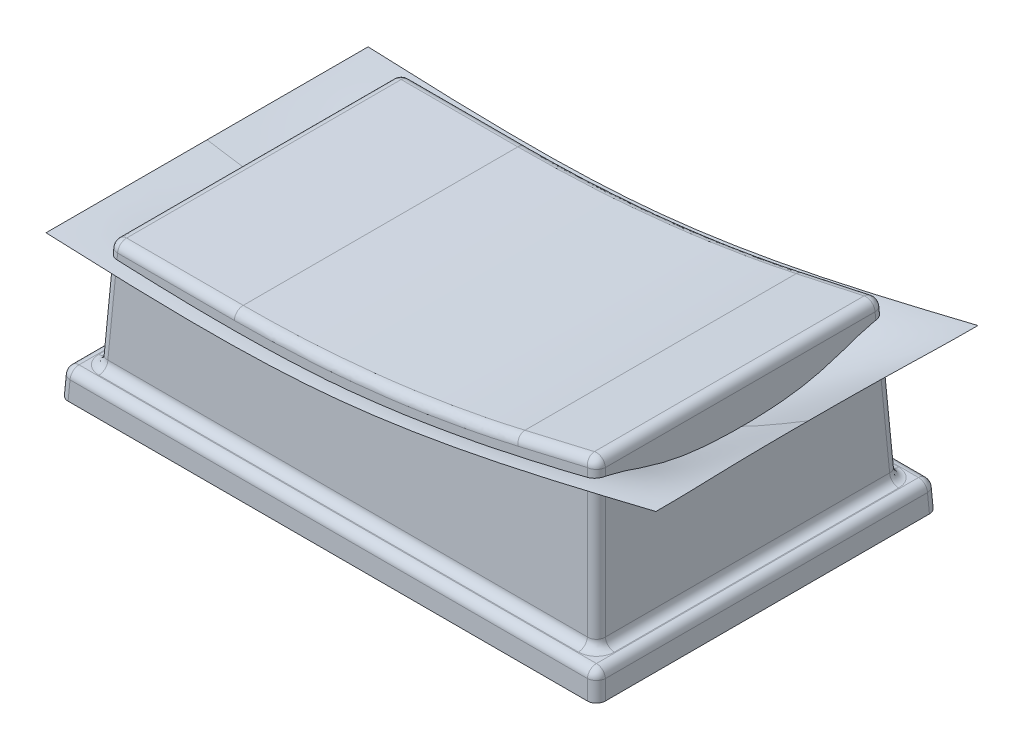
SolidWorks part; units mm, degrees
ref_plane "Front Plane" through (0, 0, 0) normal (0, 0, 1) x (1, 0, 0)
ref_plane "Top Plane" through (0, 0, 0) normal (0, 1, 0) x (1, 0, 0)
ref_plane "Right Plane" through (0, 0, 0) normal (1, 0, 0) x (0, 0, -1)
imported_body "Imported1"
sketch "Sketch1" plane through (0, 0, 0) normal (0, 0, 1) x (1, 0, 0)
  spline S0 degree 3 poles (-82.2035, 35.178) (-63.6226, 32.2544) (-17.5801, 25.01) (43.7854, 25.1695) (77.6075, 45.5276) (87.244, 51.328) knots 0 0 0 0 0.32607 0.807985 1 1 1 1
ref_plane "Plane1" through (0, 0, -45.3786) normal (0, 0, 1) x (1, 0, 0)
sketch "Sketch2" plane through (0, 0, -45.3786) normal (0, 0, 1) x (1, 0, 0)
  spline S0 degree 3 poles (-82.2035, 35.178) (-56.2875, 34.104) (1.7873, 31.6974) (58.3404, 45.4697) (89.6566, 53.0961) knots 0 0 0 0 0.446252 1 1 1 1
surface "Surface-Loft1"
mirror "Mirror1" about plane through (0, 0, 0) normal (0, 0, 1)
surface "Surface-Knit1"
